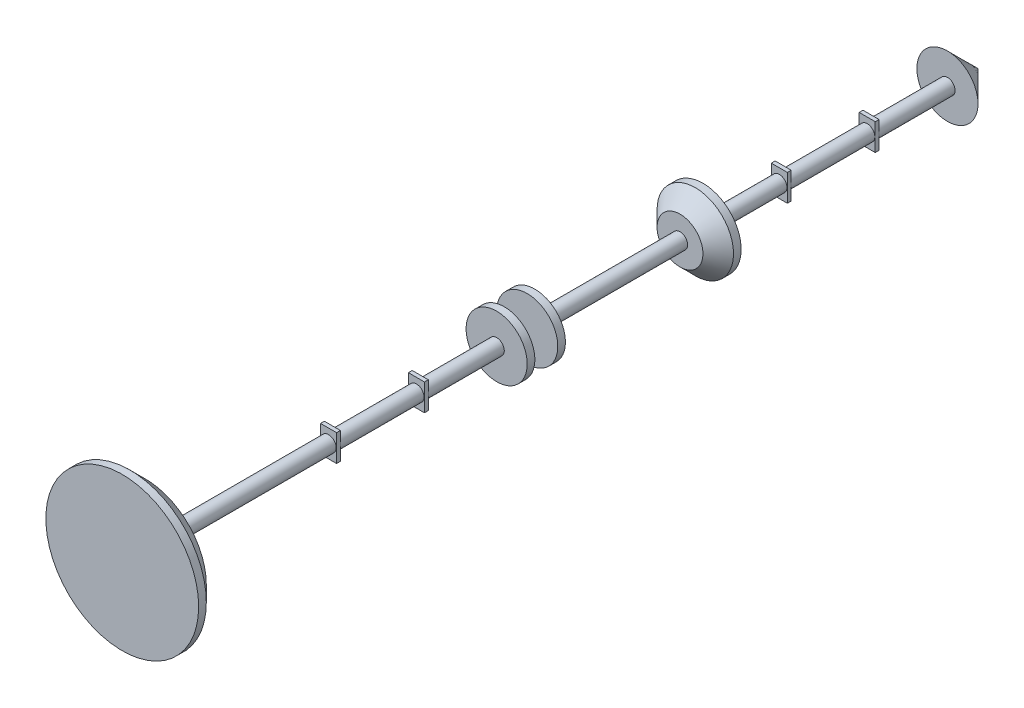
SolidWorks part; units mm, degrees
ref_plane "Plan de face" through (0, 0, 0) normal (0, 0, 1) x (1, 0, 0)
ref_plane "Plan de dessus" through (0, 0, 0) normal (0, 1, 0) x (1, 0, 0)
ref_plane "Plan de droite" through (0, 0, 0) normal (1, 0, 0) x (0, 0, -1)
sketch "Esquisse1" plane through (0, 0, 0) normal (0, 0, 1) x (1, 0, 0)
  circle A0 centre (0, 0) radius 10
  dimension "D1" = 20
extrude "Extrusion1" add sketch "Esquisse1" along normal blind 240
sketch "Esquisse2" plane through (0, 0, 0) normal (0, 0, -1) x (-1, 0, 0)
  line L1 (-10.5, 17.5) -> (10.5, 17.5)
  line L2 (-10.5, 17.5) -> (-10.5, -17.5)
  line L3 (-10.5, -17.5) -> (10.5, -17.5)
  line L4 (10.5, 17.5) -> (10.5, -17.5)
  dimension "D1" = 21
  dimension "D2" = 10.5
  dimension "D3" = 35
  dimension "D4" = 17.5
extrude "Extrusion2" add sketch "Esquisse2" along normal blind 5
sketch "Esquisse3" plane through (0, 0, -5) normal (0, 0, -1) x (-1, 0, 0)
  circle A0 centre (0, 0) radius 10 construction
  circle A1 centre (0, 0) radius 10
extrude "Extrusion3" add sketch "Esquisse3" along normal blind 110
sketch "Esquisse4" plane through (0, 0, -115) normal (0, 0, -1) x (-1, 0, 0)
  line L4 (-10.5, 17.5) -> (-10.5, -17.5)
  line L5 (-10.5, -17.5) -> (10.5, -17.5)
  line L6 (10.5, -17.5) -> (10.5, 17.5)
  line L7 (10.5, 17.5) -> (-10.5, 17.5)
  line L8 (-10.5, 17.5) -> (-10.5, -17.5)
  line L9 (-10.5, -17.5) -> (10.5, -17.5)
  line L10 (10.5, -17.5) -> (10.5, 17.5)
  line L11 (10.5, 17.5) -> (-10.5, 17.5)
  dimension "D1" = 0
extrude "Extrusion4" add sketch "Esquisse4" along normal blind 5
sketch "Esquisse5" plane through (0, 0, -120) normal (0, 0, -1) x (-1, 0, 0)
  circle A0 centre (0, 0) radius 10 construction
  circle A1 centre (0, 0) radius 10
extrude "Extrusion5" add sketch "Esquisse5" along normal blind 100
sketch "Esquisse7" plane through (0, 0, 240) normal (0, 0, 1) x (1, 0, 0)
  circle A0 centre (0, 0) radius 100
  dimension "D1" = 200
extrude "Extrusion7" add sketch "Esquisse7" along normal blind 30
sketch "Esquisse9" plane through (0, 0, 0) normal (0, 1, 0) x (1, 0, 0)
  line L0 (0, -240) -> (0, -210) construction
  line L2 (10, -240) -> (-10, -240) construction
  dimension "D1" = 30
sketch "Esquisse12" plane through (0, 0, -220) normal (0, 0, -1) x (-1, 0, 0)
  circle A0 centre (0, 0) radius 40
  dimension "D1" = 80
extrude "Extrusion10" add sketch "Esquisse12" along normal blind 10
sketch "Esquisse13" plane through (0, 0, -230) normal (0, 0, -1) x (-1, 0, 0)
  circle A0 centre (0, 0) radius 10 construction
  circle A1 centre (0, 0) radius 10
extrude "Extrusion11" add sketch "Esquisse13" along normal blind 30
sketch "Esquisse14" plane through (0, 0, -260) normal (0, 0, -1) x (-1, 0, 0)
  circle A0 centre (0, 0) radius 40 construction
  circle A1 centre (0, 0) radius 40
extrude "Extrusion12" add sketch "Esquisse14" along normal blind 10
sketch "Esquisse15" plane through (0, 0, -270) normal (0, 0, -1) x (-1, 0, 0)
  circle A0 centre (0, 0) radius 10 construction
  circle A1 centre (0, 0) radius 10
extrude "Extrusion13" add sketch "Esquisse15" along normal blind 190
sketch "Esquisse16" plane through (0, 0, -460) normal (0, 0, -1) x (-1, 0, 0)
  circle A1 centre (0, 0) radius 50
  dimension "D1" = 100
extrude "Extrusion14" add sketch "Esquisse16" along normal blind 30
sketch "Esquisse26" plane through (0, 0, -490) normal (0, 0, -1) x (-1, 0, 0)
  circle A0 centre (0, 0) radius 10 construction
  circle A1 centre (0, 0) radius 10
extrude "Extrusion15" add sketch "Esquisse26" along normal blind 100
sketch "Esquisse29" plane through (0, 0, -590) normal (0, 0, -1) x (-1, 0, 0)
  line L4 (10.5, 17.5) -> (-10.5, 17.5)
  line L5 (-10.5, 17.5) -> (-10.5, -17.5)
  line L6 (-10.5, -17.5) -> (10.5, -17.5)
  line L7 (10.5, -17.5) -> (10.5, 17.5)
  line L8 (10.5, 17.5) -> (-10.5, 17.5)
  line L9 (-10.5, 17.5) -> (-10.5, -17.5)
  line L10 (-10.5, -17.5) -> (10.5, -17.5)
  line L11 (10.5, -17.5) -> (10.5, 17.5)
  dimension "D1" = 0
extrude "Extrusion16" add sketch "Esquisse29" along normal blind 5
sketch "Esquisse30" plane through (0, 0, -595) normal (0, 0, -1) x (-1, 0, 0)
  circle A0 centre (0, 0) radius 10 construction
  circle A1 centre (0, 0) radius 10
extrude "Extrusion17" add sketch "Esquisse30" along normal blind 110
sketch "Esquisse31" plane through (0, 0, -705) normal (0, 0, -1) x (-1, 0, 0)
  line L4 (10.5, -17.5) -> (10.5, 17.5)
  line L5 (10.5, 17.5) -> (-10.5, 17.5)
  line L6 (-10.5, 17.5) -> (-10.5, -17.5)
  line L7 (-10.5, -17.5) -> (10.5, -17.5)
  line L8 (10.5, -17.5) -> (10.5, 17.5)
  line L9 (10.5, 17.5) -> (-10.5, 17.5)
  line L10 (-10.5, 17.5) -> (-10.5, -17.5)
  line L11 (-10.5, -17.5) -> (10.5, -17.5)
  dimension "D1" = 0
extrude "Extrusion18" add sketch "Esquisse31" along normal blind 5
sketch "Esquisse32" plane through (0, 0, -710) normal (0, 0, -1) x (-1, 0, 0)
  circle A0 centre (0, 0) radius 10 construction
  circle A1 centre (0, 0) radius 10
extrude "Extrusion19" add sketch "Esquisse32" along normal blind 100
sketch "Esquisse33" plane through (0, 0, 0) normal (0, 1, 0) x (1, 0, 0)
  line L0 (0, 810) -> (0, 850)
  line L1 (10, 810) -> (-10, 810) construction
  line L2 (0, 850) -> (-40, 810)
  line L3 (-40, 810) -> (0, 810)
  dimension "D1" = 40
  dimension "D2" = 40
revolve "Révolution1" add sketch "Esquisse33" angle 360 about L0
sketch "Esquisse34" plane through (0, 0, 0) normal (0, 1, 0) x (1, 0, 0)
  line L0 (40, 230) -> (-40, 230) construction
  line L1 (-40, 260) -> (40, 260)
  line L2 (-40, 260) -> (-40, 230)
  line L3 (-40, 230) -> (40, 230)
  line L4 (40, 260) -> (40, 230)
extrude "Enlèv. mat.-Extru.1" cut sketch "Esquisse34" against normal blind 20 and the other way blind 20
sketch "Esquisse36" plane through (0, 0, 0) normal (0, 1, 0) x (1, 0, 0)
  point P0 (0, 850)
chamfer "Chanfrein4" distance 20 angle 45 1 edges at (100, 0, 240)
chamfer "Chanfrein5" distance 20 angle 45 1 edges at (-50, 0, -460)
sketch "Esquisse37" plane through (0, 0, 0) normal (1, 0, 0) x (0, 0, -1)
  line L0 (460, 0) -> (430, 0) construction
  line L1 (460, 30) -> (460, -30) construction
  dimension "D1" = 30
